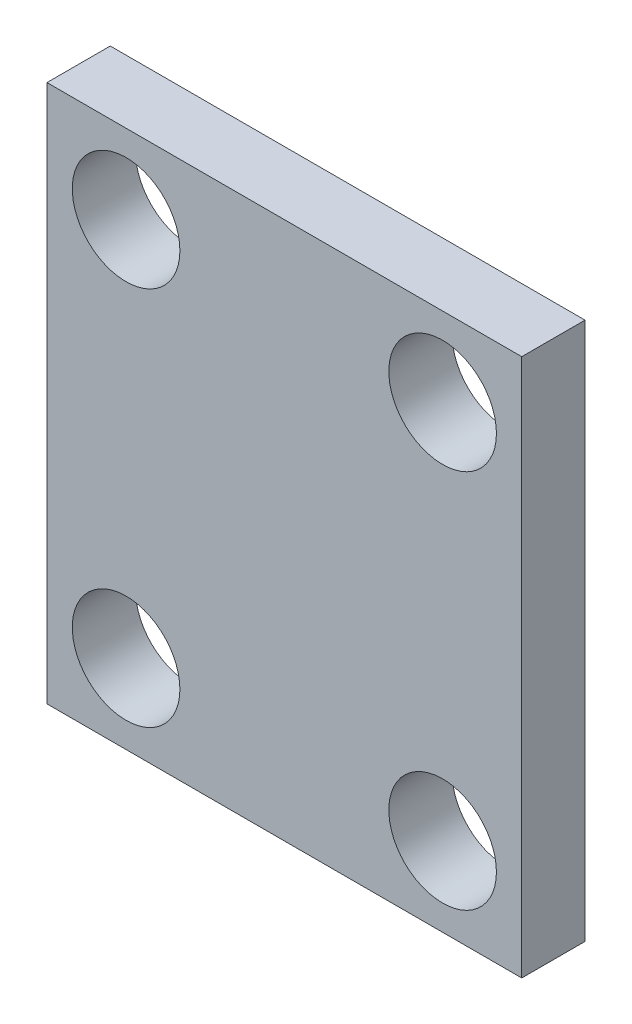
SolidWorks part; units mm, degrees
ref_plane "Face" through (0, 0, 0) normal (0, 0, 1) x (1, 0, 0)
ref_plane "Dessus" through (0, 0, 0) normal (0, 1, 0) x (1, 0, 0)
ref_plane "Profil" through (0, 0, 0) normal (1, 0, 0) x (0, 0, -1)
sketch "Esquisse1" plane through (0, 0, 0) normal (0, 0, 1) x (1, 0, 0)
  line L1 (0, 0) -> (15, 0)
  line L2 (0, 0) -> (0, 17)
  line L3 (0, 17) -> (15, 17)
  line L4 (15, 0) -> (15, 17)
  dimension "D1" = 17
  dimension "D2" = 15
extrude "Extrusion1" add sketch "Esquisse1" along normal blind 2
hole_wizard "Dégagement M31" positions "Esquisse3" profile "Esquisse2" hole size "M3" standard "ISO"
sketch "Esquisse3" plane through (0, 0, 2) normal (0, 0, 1) x (1, 0, 0)
  line L0 (15, 17) -> (0, 17) construction
  line L1 (0, 17) -> (0, 0) construction
  point P0 (2.5, 14.5)
  dimension "D1" = 2.5
  dimension "D2" = 2.5
sketch "Esquisse2" plane through (2.5, 14.5, 2) normal (1, 0, 0) x (0, -1, 0)
  line L0 (0, 0) -> (0, 2)
  line L1 (0, 2) -> (1.7, 2)
  line L2 (1.7, 2) -> (1.7, 0)
  line L5 (1.7, 0) -> (0, 0)
  line L11 (0, -6.35) -> (0, 107.95) construction
  dimension "Diamètre du perçage jusqu'au prochain" = 3.4
  dimension "Profondeur du perçage jusqu'au prochain" = 2
pattern_linear "Répétition linéaire1" count 2 spacing 10 along (1, 0, 0) count 2 spacing 12 along (0, -1, 0) of "Dégagement M31"
